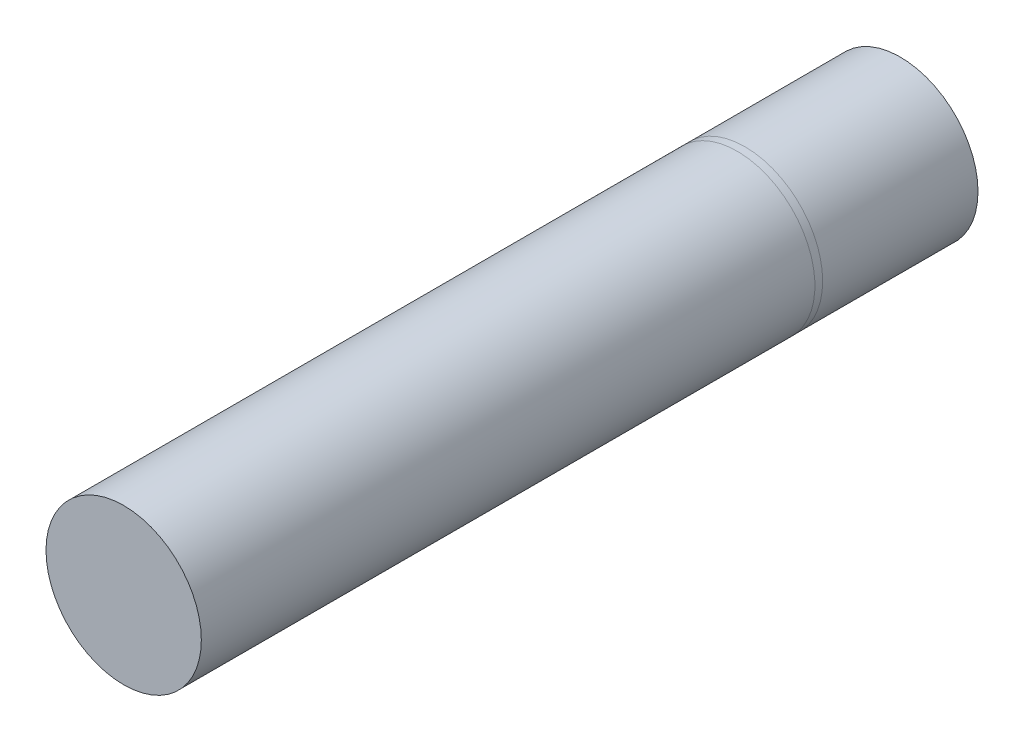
SolidWorks part; units mm, degrees
ref_plane "Ebene vorne" through (0, 0, 0) normal (0, 0, 1) x (1, 0, 0)
ref_plane "Ebene oben" through (0, 0, 0) normal (0, 1, 0) x (1, 0, 0)
ref_plane "Ebene rechts" through (0, 0, 0) normal (1, 0, 0) x (0, 0, -1)
sketch "Skizze1" plane through (0, 0, 0) normal (0, 0, 1) x (1, 0, 0)
  circle A0 centre (0, 0) radius 10
  dimension "D1" = 20
extrude "Linear austragen1" add sketch "Skizze1" along normal blind 100
sketch "Skizze4" plane through (0, 0, 0) normal (0, 1, 0) x (1, 0, 0)
  line L0 (-15, -20) -> (15, -20)
  line L1 (-15, -20) -> (-15, -21)
  line L2 (-15, -21) -> (15, -21)
  line L3 (15, -21) -> (15, -20)
  line L4 (10, 0) -> (-10, 0) construction
  line L5 (0, -100) -> (0, 0) construction
  line L6 (0, 0) -> (0, -29.7656) construction
  dimension "D1" = 20
  dimension "D2" = 1
  dimension "D3" = 30
equation "\"LÄNGE\"=0"
equation "\"BREITE\"=0"
equation "\"HÖHE\"=0"
equation "\"DURCHMESSER\"=0"
equation "\"Stückzahl\"= 1"
